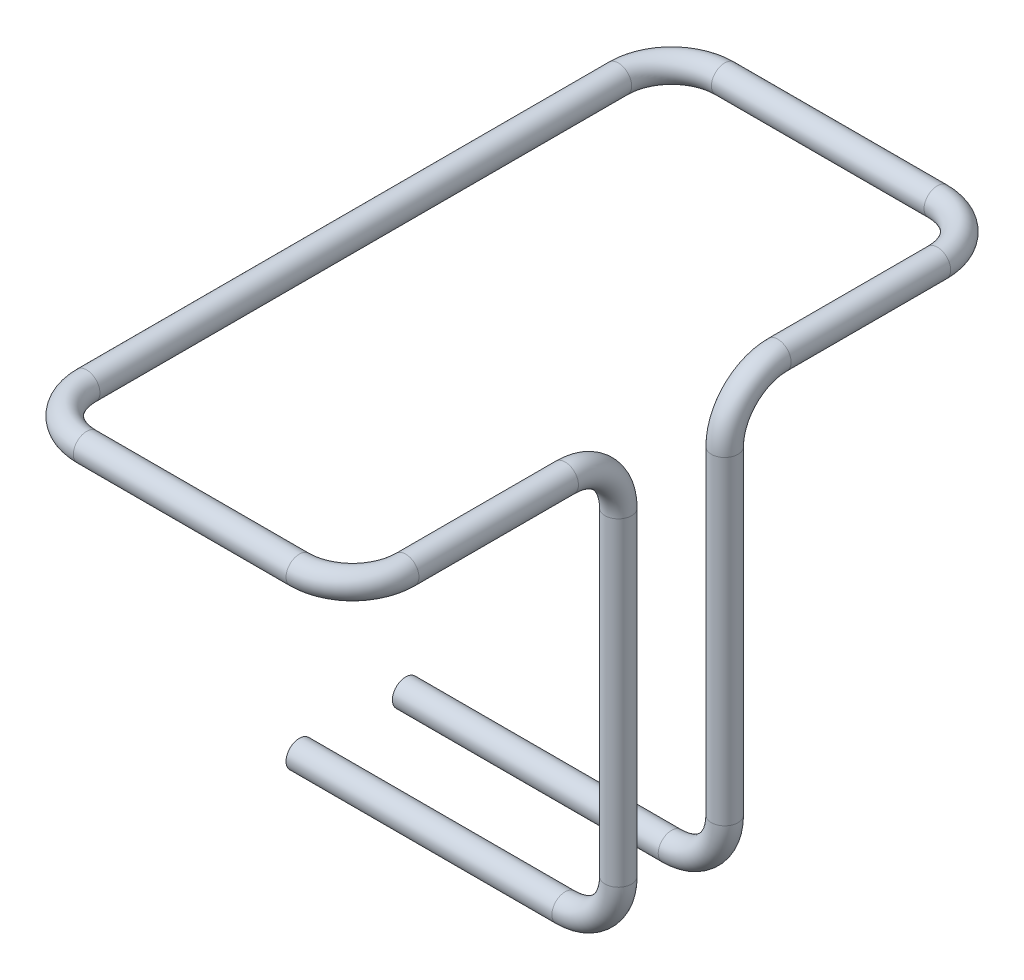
SolidWorks part; units mm, degrees
ref_plane "Front" through (0, 0, 0) normal (0, 0, 1) x (1, 0, 0)
ref_plane "Top" through (0, 0, 0) normal (0, 1, 0) x (1, 0, 0)
ref_plane "Right" through (0, 0, 0) normal (1, 0, 0) x (0, 0, -1)
sketch3d "SWEPT PATH"
  line L0 (0, 0, 0) -> (63.5, 0, 0)
  line L1 (76.2, 12.7, 0) -> (76.2, 88.9, 0)
  line L2 (76.2, 101.6, -12.7) -> (76.2, 101.6, -50.8)
  line L3 (63.5, 101.6, -63.5) -> (12.7, 101.6, -63.5)
  line L4 (0, 101.6, -50.8) -> (0, 101.6, 76.2)
  line L5 (12.7, 101.6, 88.9) -> (63.5, 101.6, 88.9)
  line L6 (76.2, 101.6, 76.2) -> (76.2, 101.6, 38.1)
  line L7 (76.2, 88.9, 25.4) -> (76.2, 12.7, 25.4)
  line L8 (63.5, 0, 25.4) -> (0, 0, 25.4)
  arc A0 (63.5, 0, 0) -> (76.2, 12.7, 0) centre (63.5, 12.7, 0) ccw
  arc A1 (76.2, 88.9, 0) -> (76.2, 101.6, -12.7) centre (76.2, 88.9, -12.7) ccw
  arc A2 (76.2, 101.6, -50.8) -> (63.5, 101.6, -63.5) centre (63.5, 101.6, -50.8) ccw
  arc A3 (12.7, 101.6, -63.5) -> (0, 101.6, -50.8) centre (12.7, 101.6, -50.8) ccw
  arc A4 (0, 101.6, 76.2) -> (12.7, 101.6, 88.9) centre (12.7, 101.6, 76.2) ccw
  arc A5 (63.5, 101.6, 88.9) -> (76.2, 101.6, 76.2) centre (63.5, 101.6, 76.2) ccw
  arc A6 (76.2, 101.6, 38.1) -> (76.2, 88.9, 25.4) centre (76.2, 88.9, 38.1) ccw
  arc A7 (76.2, 12.7, 25.4) -> (63.5, 0, 25.4) centre (63.5, 12.7, 25.4) ccw
  point P13 (76.2, 0, 0)
  point P14 (63.5, 12.7, 12.7)
  point P17 (76.2, 101.6, 0)
  point P18 (63.5, 88.9, -12.7)
  point P21 (76.2, 101.6, -63.5)
  point P22 (63.5, 114.3, -50.8)
  point P25 (0, 101.6, -63.5)
  point P26 (12.7, 114.3, -50.8)
  point P29 (0, 101.6, 88.9)
  point P30 (12.7, 114.3, 76.2)
  point P33 (76.2, 101.6, 88.9)
  point P34 (63.5, 114.3, 76.2)
  point P37 (76.2, 101.6, 25.4)
  point P38 (63.5, 88.9, 38.1)
  point P41 (76.2, 0, 25.4)
  point P42 (63.5, 12.7, 12.7)
  dimension "D10" = 12.7
  dimension "D11" = 12.7
  dimension "D12" = 12.7
  dimension "D13" = 12.7
  dimension "D14" = 12.7
  dimension "D15" = 12.7
  dimension "D16" = 12.7
  dimension "D17" = 12.7
  dimension "D1" = 76.2
  dimension "D2" = 101.6
  dimension "D3" = 76.2
  dimension "D4" = 63.5
  dimension "D5" = 152.4
  dimension "D6" = 76.2
  dimension "D7" = 63.5
  dimension "D8" = 101.6
  dimension "D9" = 76.2
sketch "SWEPT PROFILE" plane through (0, 0, 0) normal (1, 0, 0) x (0, 0, -1)
  circle A0 centre (0, 0) radius 3.175
  dimension "D1" = 6.35
sweep "Sweep1" add profiles "SWEPT PROFILE" path "SWEPT PATH"
